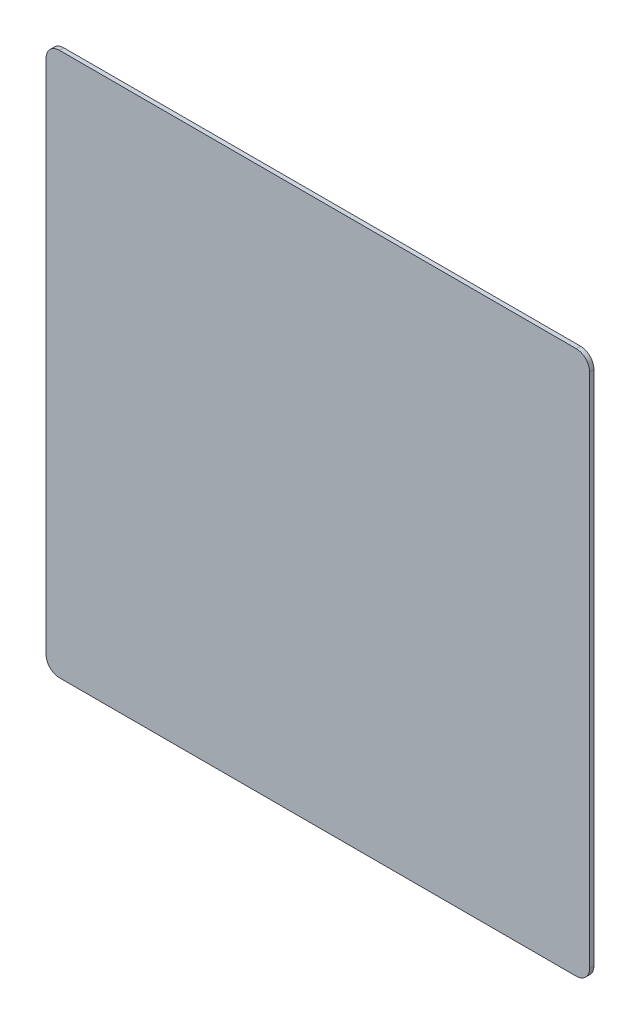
SolidWorks part; units mm, degrees
ref_plane "Plan1" through (0, 0, 0) normal (0, 0, 1) x (1, 0, 0)
ref_plane "Plan2" through (0, 0, 0) normal (0, 1, 0) x (1, 0, 0)
ref_plane "Plan3" through (0, 0, 0) normal (1, 0, 0) x (0, 0, -1)
sketch "Esquisse1" plane through (0, 0, 0) normal (0, 0, 1) x (1, 0, 0)
  line L0 (29.9497, 30.9997) -> (-29.9497, 30.9997)
  line L1 (31.4997, -30.4497) -> (31.4997, 29.4497)
  line L2 (-29.9497, -31.9997) -> (29.9497, -31.9997)
  line L3 (-31.4997, 29.4497) -> (-31.4997, -30.4497)
  line L4 (29.9497, 32) -> (-29.9497, 32) construction
  arc A0 (31.4997, 29.4497) -> (29.9497, 30.9997) centre (29.9497, 29.4497) ccw
  arc A1 (29.9497, -31.9997) -> (31.4997, -30.4497) centre (29.9497, -30.4497) ccw
  arc A2 (-31.4997, -30.4497) -> (-29.9497, -31.9997) centre (-29.9497, -30.4497) ccw
  arc A3 (-29.9497, 30.9997) -> (-31.4997, 29.4497) centre (-29.9497, 29.4497) ccw
  arc A4 (-29.9497, 32) -> (-32.5, 29.4497) centre (-29.9497, 29.4497) ccw construction
  arc A5 (32.5, 29.4497) -> (29.9497, 32) centre (29.9497, 29.4497) ccw construction
  arc A6 (29.9497, -33) -> (32.5, -30.4497) centre (29.9497, -30.4497) ccw construction
  arc A7 (-32.5, -30.4497) -> (-29.9497, -33) centre (-29.9497, -30.4497) ccw construction
  dimension "D1" = 1.55
extrude "Base-Extrusion" add sketch "Esquisse1" along normal blind 0.5
